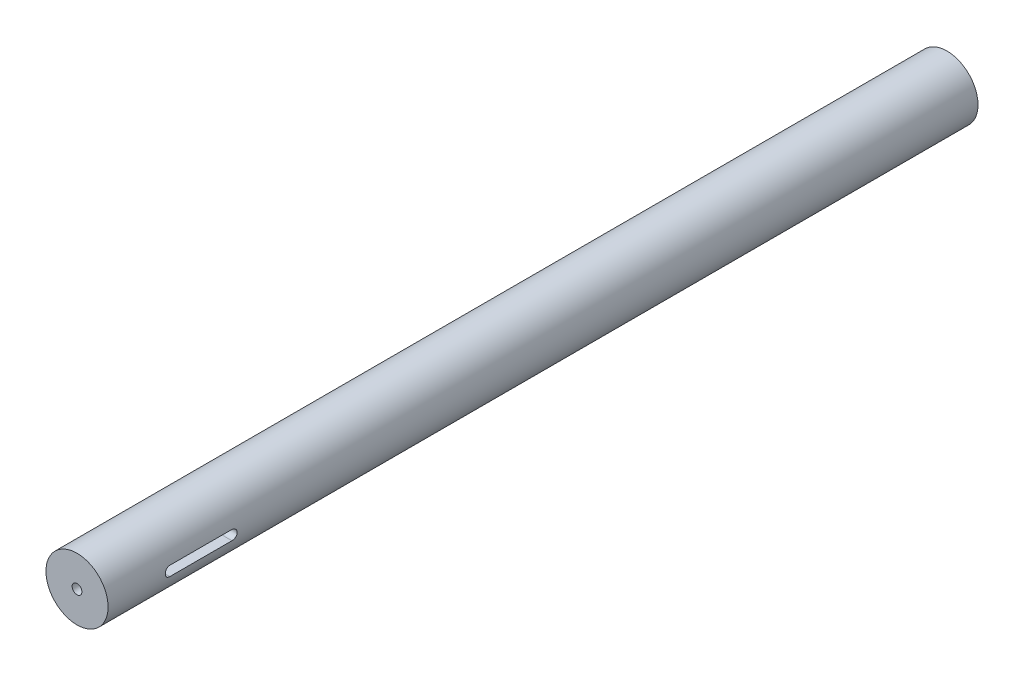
SolidWorks part; units mm, degrees
ref_plane "Front Plane" through (0, 0, 0) normal (0, 0, 1) x (1, 0, 0)
ref_plane "Top Plane" through (0, 0, 0) normal (0, 1, 0) x (1, 0, 0)
ref_plane "Right Plane" through (0, 0, 0) normal (1, 0, 0) x (0, 0, -1)
sketch "Sketch1" plane through (0, 0, 0) normal (0, 0, 1) x (1, 0, 0)
  circle A0 centre (0, 0) radius 6.35
extrude "Boss-Extrude1" add sketch "Sketch1" along normal blind 177.8
sketch "Sketch2" plane through (0, 0, 0) normal (1, 0, 0) x (0, 0, -1)
  line L0 (-165.1, 1) -> (-152.4, 1)
  line L2 (-165.1, -1) -> (-152.4, -1)
  arc A1 (-165.1, 1) -> (-165.1, -1) centre (-165.1, 0) ccw
  arc A2 (-152.4, -1) -> (-152.4, 1) centre (-152.4, 0) ccw
extrude "Cut-Extrude1" cut sketch "Sketch2" along normal blind 177.8
sketch "Sketch3" plane through (0, 0, 177.8) normal (0, 0, 1) x (1, 0, 0)
  circle A0 centre (0, 0) radius 1
extrude "Cut-Extrude2" cut sketch "Sketch3" against normal up to vertex
